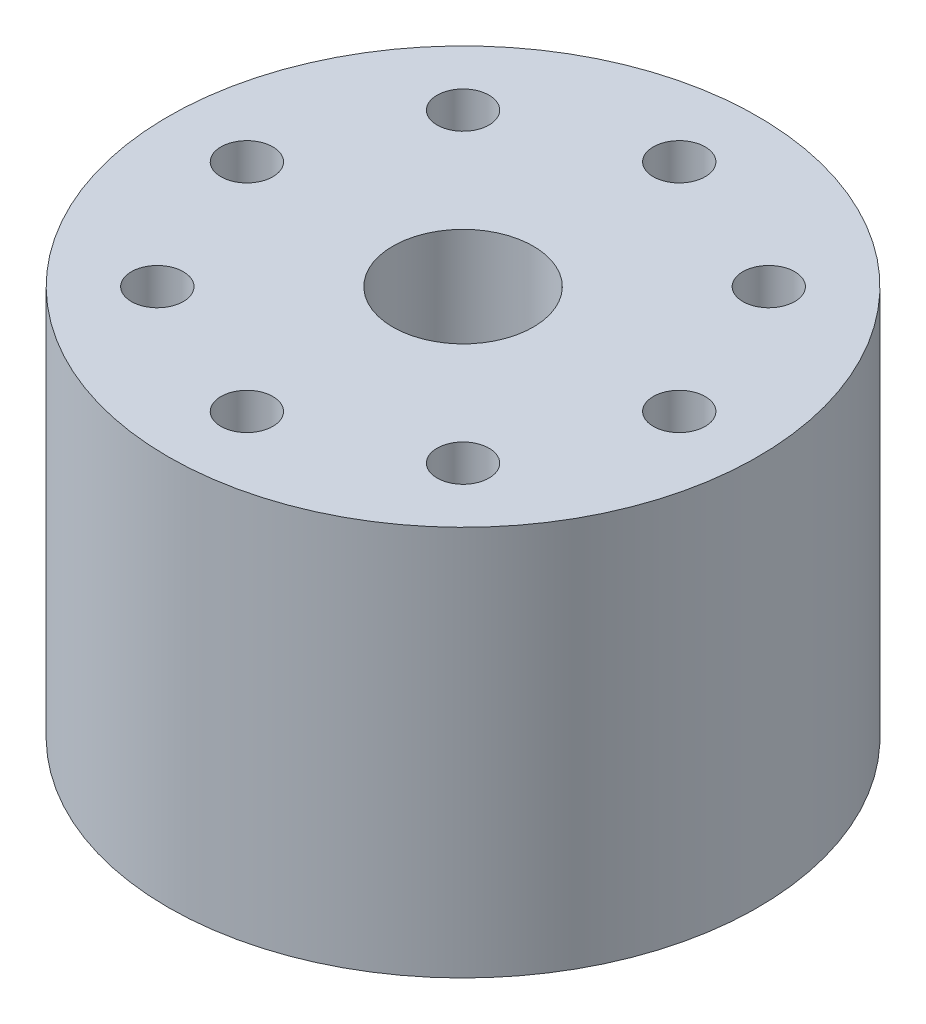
SolidWorks part; units mm, degrees
ref_plane "Front Plane" through (0, 0, 0) normal (0, 0, 1) x (1, 0, 0)
ref_plane "Top Plane" through (0, 0, 0) normal (0, 1, 0) x (1, 0, 0)
ref_plane "Right Plane" through (0, 0, 0) normal (1, 0, 0) x (0, 0, -1)
sketch "Sketch1" plane through (0, 0, 0) normal (0, 1, 0) x (1, 0, 0)
  circle A0 centre (0, 0) radius 37.5
  dimension "D1" = 75
extrude "Outer Cylinder" add sketch "Sketch1" along normal blind 49.65
sketch "Sketch2" plane through (0, 49.65, 0) normal (0, 1, 0) x (1, 0, 0)
  circle A0 centre (0, 0) radius 8.93
  dimension "D1" = 17.86
extrude "NPT Hole" cut sketch "Sketch2" against normal blind 23
sketch "Sketch3" plane through (0, 0, 0) normal (0, -1, 0) x (1, 0, 0)
  circle A0 centre (0, 0) radius 15
  dimension "D1" = 30
extrude "Outer Leaflet Diameter" cut sketch "Sketch3" against normal blind 5
sketch "Sketch4" plane through (0, 0, 0) normal (0, -1, 0) x (1, 0, 0)
  circle A0 centre (0, 0) radius 19
  dimension "D1" = 38
extrude "Depth" cut sketch "Sketch4" against normal blind 3.15
ref_plane "Plane1" through (0, 3.15, 0) normal (0, -1, 0) x (-1, 0, 0)
sketch "Sketch6" plane through (0, 0, 0) normal (0, 0, 1) x (1, 0, 0)
  line L0 (0, 3.15) -> (-15, 3.15)
  line L1 (-19, 3.15) -> (19, 3.15) construction
  line L2 (0, 3.15) -> (0, 24.45)
  line L3 (0, 24.45) -> (-15, 24.45)
  spline S0 degree 2 poles (-15, 24.45) (-24, 13.8) (-15, 3.15) knots 0 0 0 1 1 1
revolve "Aortic Root" cut sketch "Sketch6" angle 360 about L2
ref_plane "Plane3" through (0, 26.65, 0) normal (0, 1, 0) x (1, 0, 0)
ref_plane "Plane5" through (0, 24.45, 0) normal (0, -1, 0) x (-1, 0, 0)
sketch "Sketch8" plane through (0, 0, 0) normal (0, 0, 1) x (1, 0, 0)
  line L0 (0, 26.65) -> (0, 24.45)
  line L1 (8.93, 26.65) -> (-8.93, 26.65) construction
  line L2 (-15, 24.45) -> (15, 24.45) construction
  line L3 (0, 24.45) -> (-15, 24.45)
  line L4 (-15, 24.45) -> (-15, 26.65)
  line L5 (-15, 26.65) -> (0, 26.65)
revolve "Ascending Aorta" cut sketch "Sketch8" angle 360 about L0
sketch "Sketch9" plane through (0, 49.65, 0) normal (0, 1, 0) x (1, 0, 0)
  line L0 (0, 0) -> (0, -27.5) construction
  line L1 (0, 0) -> (-19.4454, -19.4454) construction
  circle A0 centre (0, -27.5) radius 3.3
  circle A1 centre (0, 0) radius 27.5
  circle A2 centre (-19.4454, -19.4454) radius 3.3
  circle A3 centre (-27.5, 0) radius 3.3
  circle A4 centre (-19.4454, 19.4454) radius 3.3
  circle A5 centre (0, 27.5) radius 3.3
  circle A6 centre (19.4454, 19.4454) radius 3.3
  circle A7 centre (27.5, 0) radius 3.3
  circle A8 centre (19.4454, -19.4454) radius 3.3
  dimension "D1" = 6.6
  dimension "D3" = 55
  dimension "D2" = 27.5
  dimension "D5" = 45
  dimension "D4" = 8
extrude "Bolt Holes" cut sketch "Sketch9" against normal through all contours A1 A8 | A1 A7 | A1 A6 | A1 A6 | A1 A5 | A1 A5 | A1 A4 | A1 A4 | A1 A3 | A1 A3 | A1 A2 | A1 A2 | A0 A1 | A1 A0 | A1 A8
chamfer "Chamfer3" distance 6 angle 40 1 edges at (0, 26.65, 8.93)
equation "\"A\"= 30"
equation "\"Outer Leaflet Diameter\"= \"A\""
equation "\"Aortic Root Height\"= .71 * \"A\""
equation "\"D2@Sketch6\"=\"A\"/2"
equation "\"D3@Sketch6\"= \"A\" / 2"
equation "\"Max Diameter Height\"= \"A\" * ( .71 / 2 )"
equation "\"Max Diameter\"= \"A\" * ( .65 )"
equation "\"D2@Sketch8\"=\"A\"/2"
